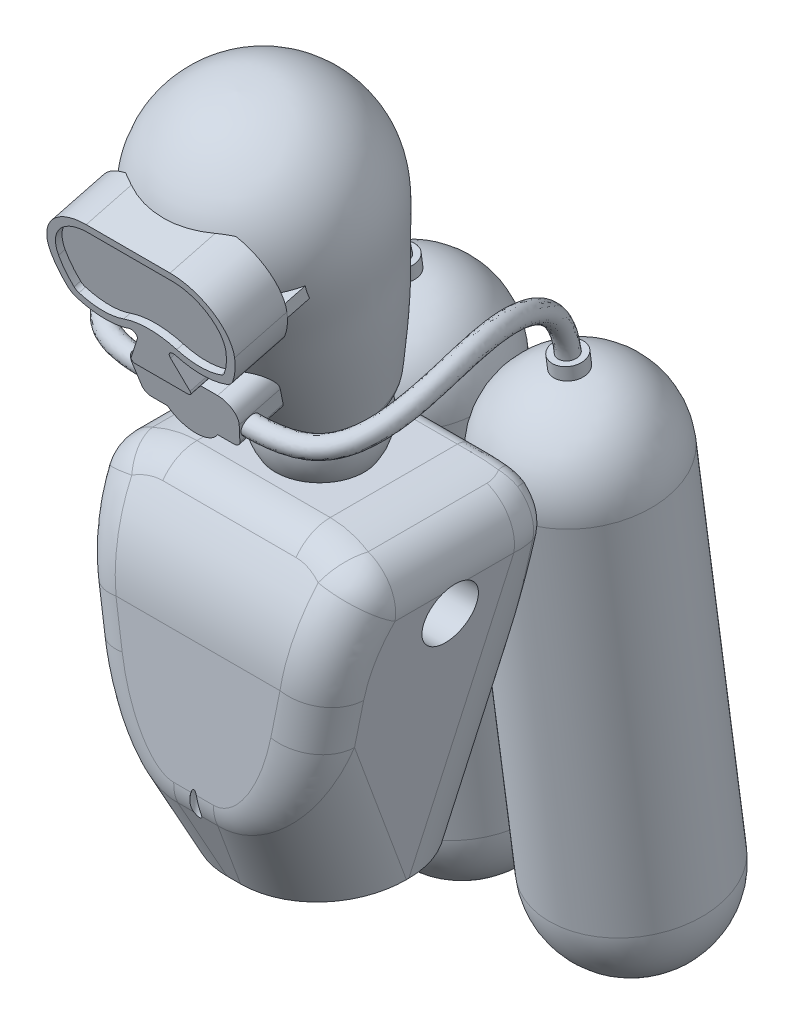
SolidWorks part; units mm, degrees
ref_plane "Plano frontal" through (0, 0, 0) normal (0, 0, 1) x (1, 0, 0)
ref_plane "Plano superior" through (0, 0, 0) normal (0, 1, 0) x (1, 0, 0)
ref_plane "Plano direito" through (0, 0, 0) normal (1, 0, 0) x (0, 0, -1)
imported_body "SW3dPS-manikin_body-1-solid1"
imported_body "SW3dPS-manikin_body-1-solid2"
imported_body "SW3dPS-manikin_body-1-solid3"
imported_body "SW3dPS-manikin_head-1-solid1"
imported_body "Peça2^SW3dPS-manikin-1-solid1"
imported_body "EspelharPeça2^SW3dPS-manikin-1-solid1"
combine bodies "Combinar1" operation type add bodies to combine 101 102 103 104 105 106
scale "Escala1" scale about centroid uniform scaling yes scale factor 6
